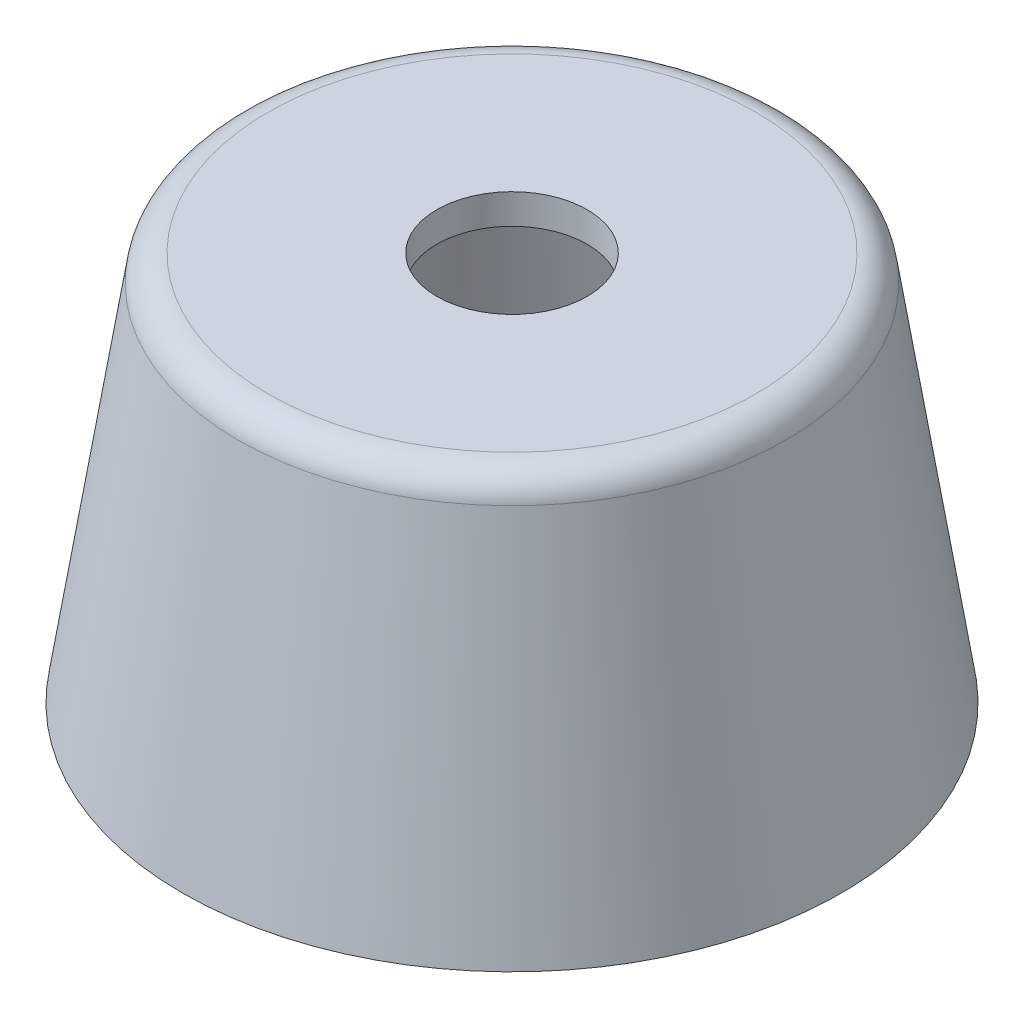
SolidWorks part; units mm, degrees
ref_plane "Alzado" through (0, 0, 0) normal (0, 0, 1) x (1, 0, 0)
ref_plane "Planta" through (0, 0, 0) normal (0, 1, 0) x (1, 0, 0)
ref_plane "Vista lateral" through (0, 0, 0) normal (1, 0, 0) x (0, 0, -1)
sketch "Croquis1" plane through (0, 0, 0) normal (0, 0, 1) x (1, 0, 0)
  line L0 (0, 0) -> (-55, 0)
  line L1 (0, 0) -> (0, 65)
  line L2 (0, 65) -> (-40.7104, 65)
  line L3 (-45.6523, 60.7603) -> (-55, 0)
  arc A0 (-45.6523, 60.7603) -> (-40.7104, 65) centre (-40.7104, 60) cw
  dimension "D1" = 5
revolve "Revolución1" add sketch "Croquis1" angle 360 about L1
shell "Vaciado1" thickness 5
sketch "Croquis2" plane through (0, 65, 0) normal (0, 1, 0) x (1, 0, 0)
  circle A0 centre (0, 0) radius 12.549
extrude "Cortar-Extruir1" cut sketch "Croquis2" against normal blind 10
